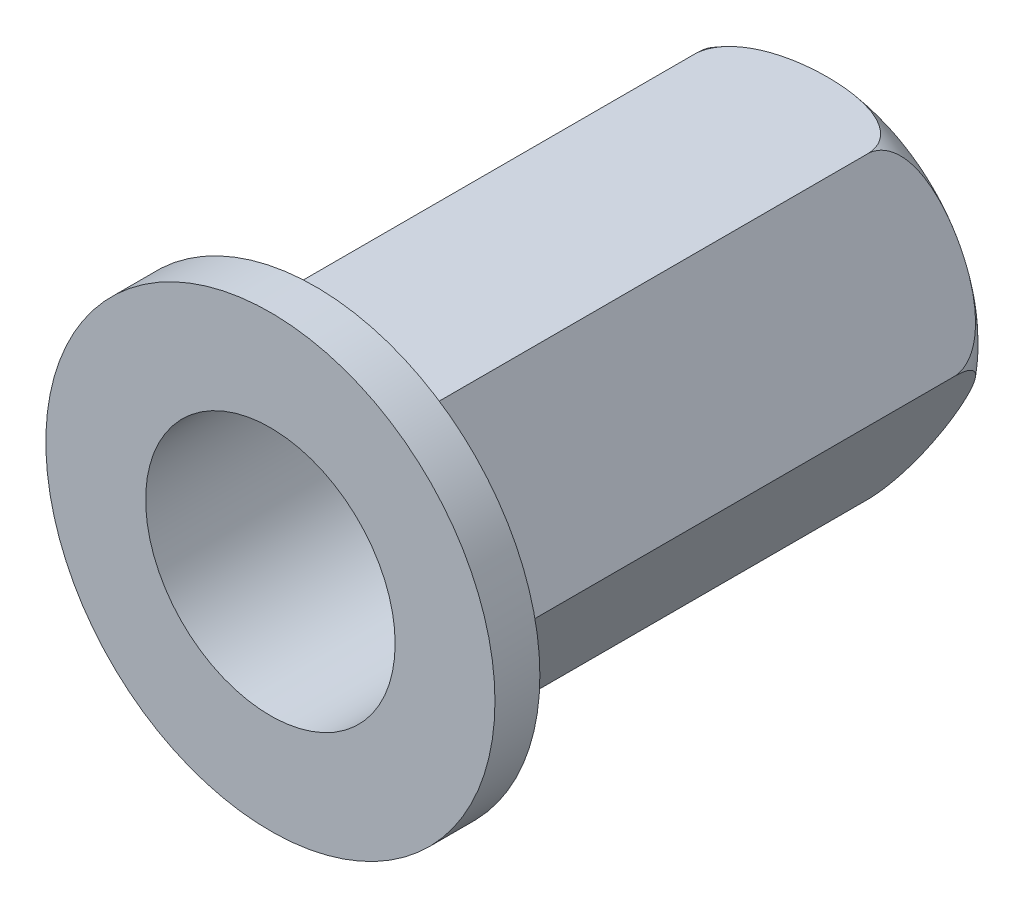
SolidWorks part; units mm, degrees
ref_plane "Front" through (0, 0, 0) normal (0, 0, 1) x (1, 0, 0)
ref_plane "Top" through (0, 0, 0) normal (0, 1, 0) x (1, 0, 0)
ref_plane "Right" through (0, 0, 0) normal (1, 0, 0) x (0, 0, -1)
other "Configuration Table"
sketch "Sketch3" plane through (0, 0, 0) normal (0, 0, 1) x (1, 0, 0)
  circle A0 centre (0, 0) radius 9
extrude "BaseHead" add sketch "Sketch3" against normal blind 1.8
sketch "Sketch4" plane through (2.8191, -1.6346, -1.8) normal (0, 0, -1) x (-1, 0, 0)
  line L1 (-0.645, 7.6346) -> (-4.1091, 1.6346)
  line L2 (-4.1091, 1.6346) -> (-0.645, -4.3654)
  line L3 (-0.645, -4.3654) -> (6.2832, -4.3654)
  line L4 (6.2832, -4.3654) -> (9.7473, 1.6346)
  line L5 (9.7473, 1.6346) -> (6.2832, 7.6346)
  line L6 (6.2832, 7.6346) -> (-0.645, 7.6346)
  circle A0 centre (2.8191, 1.6346) radius 6 construction
  circle A1 centre (2.8191, 1.6346) radius 6 construction
  circle A2 centre (2.8191, 1.6346) radius 9 construction
  dimension "s" = 12
extrude "BaseBody" add sketch "Sketch4" along normal blind 21
sketch "Sketch5" plane through (4.0795, 0.9752, 0) normal (0, 0, 1) x (1, 0, 0)
  circle A0 centre (-4.0795, -0.9752) radius 5
  circle A1 centre (-4.0795, -0.9752) radius 9 construction
extrude "Hole1" cut sketch "Sketch5" against normal blind 7.3
sketch "Sketch6" plane through (1.8124, 4.1988, -7.3) normal (0, 0, 1) x (1, 0, 0)
  circle A0 centre (-1.8124, -4.1988) radius 3.5
  circle A1 centre (-1.8124, -4.1988) radius 5 construction
extrude "Hole2" cut sketch "Sketch6" against normal through all
sketch "Sketch7" plane through (8.6603, 0, 20.3033) normal (0, 1, 0) x (-1, 0, 0)
  line L0 (8.6603, 2.4967) -> (8.6603, -3.5015) construction
  line L3 (15.5885, -43.1033) -> (12.1244, -43.1033) construction
  line L5 (15.5885, -43.1033) -> (15.5885, -22.1033) construction
  line L6 (15.5885, -43.1033) -> (13.2551, -43.1033)
  line L8 (15.5885, -43.1033) -> (15.5885, -40.77)
  arc A0 (13.2551, -43.1033) -> (15.5885, -40.77) centre (13.2551, -40.77) ccw
revolve "Cut-Revolve1" cut sketch "Sketch7" angle 360 about L0
fillet "Fillet1" radius 0.9 6 edges at (0, -6, -1.8) (-5.1962, -3, -1.8) (-5.1962, 3, -1.8) (0, 6, -1.8) (5.1962, 3, -1.8) (5.1962, -3, -1.8)
chamfer "Chamfer1" distance 0.4667 angle 45 1 edges at (3.5, 0, -22.8)
chamfer "Chamfer2" distance 1.5 angle 45 1 edges at (3.5, 0, -7.3)
sketch "Sketch9" plane through (0, 0, 0) normal (1, 0, 0) x (0, 0, -1)
  line L0 (-5.9053, 0) -> (27.963, 0) construction
  line L1 (22.0833, -3.5) -> (22.0833, -3)
  line L2 (22.0833, -3) -> (22.5833, -3)
  line L3 (22.5833, -3) -> (22.5833, -3.5)
  line L4 (22.5833, -3.5) -> (22.3333, -3.933)
  line L5 (22.3333, -3.933) -> (22.0833, -3.5)
  line L6 (22.3333, -3.5) -> (22.3333, 3.5) construction
revolve "Cut-Revolve10" [suppressed] cut sketch "Sketch9" angle 360 about L0
pattern_linear "LPattern10" [suppressed] count 25 spacing 0.6 along (0, 0, -1)
equation "\"D1@Chamfer1\" = \"D1@Sketch6\" / 15"
equation "\"D1@Chamfer2\" =  ( \"d1@Sketch5\" - \"D1@Sketch6\" )  / 2"
equation "\"r@Sketch7\" = \"D1@Chamfer1\" * 5"
equation "\"D1@Sketch9\" = (  \"D2@ThreadCosmetic1\" - \"D1@Sketch6\" )  / 2"
equation "\"D3@LPattern10\" = \"D1@Sketch9\" * 1.2 "
equation "\"D1@LPattern10\" =  (  \"l@BaseBody\" + \"k@BaseHead\" - \"l1@Hole1\" )  / \"D3@LPattern10\" - 1"
equation "\"D1@Fillet1\" = \"dk@Sketch3\" / 20"
equation "\"D2@Sketch9\" = \"D1@Sketch6\""
